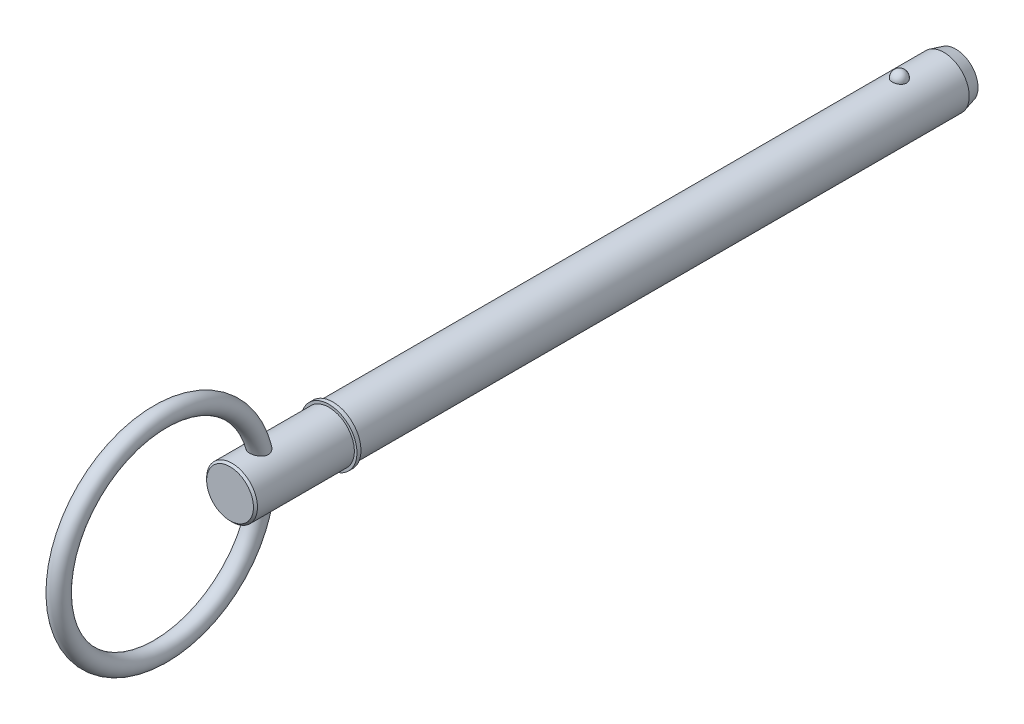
SolidWorks part; units mm, degrees
ref_plane "Front Plane" through (0, 0, 0) normal (0, 0, 1) x (1, 0, 0)
ref_plane "Top Plane" through (0, 0, 0) normal (0, 1, 0) x (1, 0, 0)
ref_plane "Right Plane" through (0, 0, 0) normal (1, 0, 0) x (0, 0, -1)
sketch "Sketch2" plane through (0, 0, 0) normal (0, 0, 1) x (1, 0, 0)
  circle A0 centre (0, 0) radius 6.35
  point P3 (0, 6.35)
  dimension "D1" = 12.7
extrude "Boss-Extrude1" add sketch "Sketch2" along normal blind 139.7
sketch "Sketch3" plane through (0, 0, 0) normal (0, 0, -1) x (-1, 0, 0)
  circle A0 centre (0, 0) radius 6.35
  dimension "D1" = 12.7
extrude "Boss-Extrude2" add sketch "Sketch3" along normal blind 15.88
chamfer "Chamfer1" distance 3 angle 15 1 edges at (-6.35, 0, -15.88)
sketch "Sketch18" plane through (0, 0, 0) normal (1, 0, 0) x (0, 0, -1)
  line L0 (12.88, 6.35) -> (-139.7, 6.35) construction
  line L1 (1.78, 8.13) -> (1.78, 4.57)
  line L2 (-139.7, -6.35) -> (12.88, -6.35) construction
  arc A0 (1.78, 8.13) -> (1.78, 4.57) centre (1.78, 6.35) ccw
  point P4 (0, 6.35)
  dimension "D1" = 14.48
revolve "Revolve1" add sketch "Sketch18" angle 360 about L1
sketch "Sketch19" plane through (0, 0, 0) normal (1, 0, 0) x (0, 0, -1)
  line L0 (-33.7288, 0) -> (-46.4542, 0) construction
sketch "Sketch20" plane through (0, 0, 0) normal (1, 0, 0) x (0, 0, -1)
  line L0 (-139.7, 0) -> (-139.7, 7)
  line L1 (-139.7, 6.35) -> (-139.7, -6.35) construction
  line L2 (-139.7, 7) -> (-140.7, 7)
  line L3 (-140.7, 7) -> (-140.7, 0)
  line L4 (-33.7288, 0) -> (-46.4542, 0) construction
  line L5 (-140.7, 0) -> (-139.7, 0)
  dimension "D1" = 7
  dimension "D2" = 1
revolve "Revolve2" add sketch "Sketch20" angle 360 about L0
sketch "Sketch21" plane through (0, 0, 139.7) normal (0, 0, -1) x (-1, 0, 0)
  circle A0 centre (0, 0) radius 6.35
  dimension "D1" = 12.7
extrude "Boss-Extrude3" add sketch "Sketch21" against normal blind 25.7
chamfer "Chamfer2" distance 0.5 angle 45 1 edges at (-6.35, 0, 165.4)
sketch "Sketch23" plane through (0, 0, 0) normal (1, 0, 0) x (0, 0, -1)
  line L0 (-165.4, 5.85) -> (-165.4, -5.85) construction
  circle A0 centre (-182.8, 0) radius 25.4
  point P2 (-157.4, 0)
  dimension "D1" = 50.8
  dimension "D2" = 8
sketch "Sketch24" plane through (0, 0, 0) normal (0, 1, 0) x (1, 0, 0)
  circle A0 centre (0, -157.4) radius 2.25
  dimension "D1" = 4.5
sweep "Sweep1" add profiles "Sketch24" path "Sketch23"
